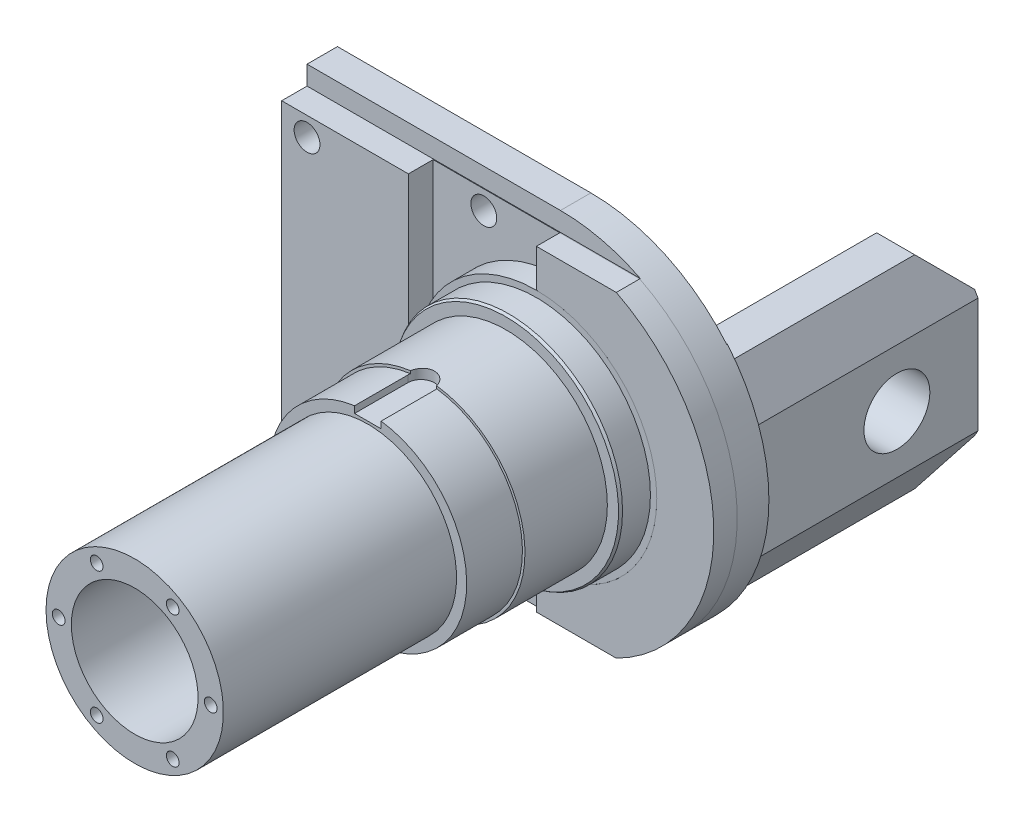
SolidWorks part; units mm, degrees
ref_plane "Face" through (0, 0, 0) normal (0, 0, 1) x (1, 0, 0)
ref_plane "Dessus" through (0, 0, 0) normal (0, 1, 0) x (1, 0, 0)
ref_plane "Droite" through (0, 0, 0) normal (1, 0, 0) x (0, 0, -1)
sketch "Esquisse1" plane through (0, 0, 0) normal (0, 0, 1) x (1, 0, 0)
  line L0 (0, 70) -> (-100, 70)
  line L1 (-100, 70) -> (-100, -70)
  line L2 (-100, -70) -> (0, -70)
  arc A0 (0, -70) -> (0, 70) centre (0, 0) ccw
  dimension "D2" = 140
  dimension "D1" = 100
extrude "Extrusion1" add sketch "Esquisse1" along normal blind 12
sketch "Esquisse2" plane through (0, 0, 12) normal (0, 0, 1) x (1, 0, 0)
  line L0 (-50, 62.5) -> (-100, 62.5)
  line L1 (-100, 70) -> (-100, -70) construction
  line L2 (-100, 62.5) -> (-100, -62.5)
  line L3 (-100, -62.5) -> (-50, -62.5)
  line L4 (-50, 62.5) -> (-50, -62.5)
  line L5 (0, 0) -> (42.8334, 0) construction
  dimension "D1" = 125
  dimension "D2" = 50
extrude "Extrusion2" add sketch "Esquisse2" along normal blind 10
sketch "Esquisse3" plane through (0, 0, 12) normal (0, 0, 1) x (1, 0, 0)
  circle A0 centre (0, 0) radius 47.5
  dimension "D1" = 95
extrude "Enlèv. mat.-Extru.2" cut sketch "Esquisse3" against normal through all
sketch "Esquisse5" plane through (0, 0, 0) normal (0, 1, 0) x (1, 0, 0)
  line L0 (0, 0) -> (0, -73.0964) construction
  line L1 (47.5, 0) -> (47.5, -33.5)
  line L2 (47.5, -33.5) -> (40, -33.5)
  line L3 (40, -33.5) -> (40, -66)
  line L4 (40, -66) -> (39, -66)
  line L5 (25, -180) -> (25, 0)
  line L6 (47.5, 0) -> (-47.5, 0) construction
  line L7 (25, 0) -> (47.5, 0)
  line L8 (47.5, 22.2377) -> (47.5, -49.295) construction
  line L9 (70, 0) -> (0, 0) construction
  line L10 (39, -66) -> (39, -88)
  line L11 (35, -180) -> (25, -180)
  line L12 (39, -88) -> (35, -88)
  line L13 (35, -88) -> (35, -180)
  dimension "D1" = 47.5
  dimension "D2" = 80
  dimension "D3" = 22.5
  dimension "D4" = 33.5
  dimension "D5" = 78
  dimension "D6" = 180
  dimension "D7" = 32.5
  dimension "D8" = 70
  dimension "D9" = 22
revolve "Révolution1" add sketch "Esquisse5" angle 360 about L0
sketch "Esquisse19" plane through (0, 0, 0) normal (0, 0, -1) x (-1, 0, 0)
  line L0 (100, 45) -> (15.2069, 45)
  line L1 (100, -45) -> (15.2069, -45)
  line L2 (-15.2069, 45) -> (-53.619, 45)
  line L3 (0, -70) -> (100, -70)
  line L4 (100, -70) -> (100, 70)
  line L5 (100, 70) -> (0, 70)
  line L7 (100, -45) -> (100, 45)
  line L9 (-15.2069, -45) -> (-53.619, -45)
  circle A0 centre (0, 0) radius 47.5 construction
  arc A1 (0, 70) -> (0, -70) centre (0, 0) ccw
  arc A2 (-53.619, 45) -> (-53.619, -45) centre (0, 0) ccw
  arc A3 (-15.2069, 45) -> (-15.2069, -45) centre (0, 0) ccw
  circle A4 centre (0, 0) radius 47.5 construction
  arc A5 (15.2069, -45) -> (15.2069, 45) centre (0, 0) ccw
  dimension "D2" = 90
  dimension "D1" = 0
extrude "Extrusion8" add sketch "Esquisse19" along normal blind 0.25
sketch "Esquisse6" plane through (0, 0, -0.25) normal (0, 0, -1) x (-1, 0, 0)
  line L0 (-55, 40) -> (-40, 40)
  line L1 (-40, 40) -> (-40, -40)
  line L2 (-40, -40) -> (-55, -40)
  line L3 (-55, -40) -> (-65, -22.6795)
  line L4 (-65, -22.6795) -> (-65, 22.6795)
  line L5 (-65, 22.6795) -> (-55, 40)
  line L6 (0, 0) -> (-67.8088, 0) construction
  dimension "D1" = 80
  dimension "D2" = 25
  dimension "D3" = 30
  dimension "D4" = 15
  dimension "D5" = 40
extrude "Extrusion5" add sketch "Esquisse6" along normal blind 87.5 separate body
sketch "Esquisse7" plane through (65, 0, 0) normal (1, 0, 0) x (0, 0, -1)
  line L0 (87.75, 22.6795) -> (87.75, -22.6795) construction
  circle A0 centre (55.75, 0) radius 13
  dimension "D2" = 26
  dimension "D1" = 32
extrude "Enlèv. mat.-Extru.3" cut sketch "Esquisse7" against normal up to next
sketch "Esquisse8" plane through (0, 0, 88) normal (0, 0, 1) x (1, 0, 0)
  line L0 (0, 0) -> (0, 69.4516) construction
  line L1 (-5.25, 40) -> (5.25, 40)
  line L2 (-5.25, 40) -> (-5.25, 36)
  line L3 (-5.25, 36) -> (5.25, 36)
  line L4 (5.25, 40) -> (5.25, 36)
  circle A0 centre (0, 0) radius 40 construction
  dimension "D1" = 10.5
  dimension "D2" = 76
extrude "Enlèv. mat.-Extru.4" cut sketch "Esquisse8" against normal blind 21
hole_wizard "Trou taraudé M61" positions "Esquisse12" profile "Esquisse11" tap size "M6" standard "ISO"
sketch "Esquisse12" plane through (0, 0, 180) normal (0, 0, 1) x (1, 0, 0)
  point P0 (30, 0)
  dimension "D1" = 30
sketch "Esquisse11" plane through (30, 0, 180) normal (1, 0, 0) x (0, -1, 0)
  line L0 (0, 0) -> (0, 16.4434)
  line L1 (0, 16.4434) -> (2.5, 15)
  line L2 (2.5, 15) -> (2.5, 0)
  line L5 (2.5, 0) -> (0, 0)
  line L10 (0, 16.4434) -> (-2.5, 15) construction
  line L11 (0, -6.35) -> (0, 107.95) construction
  dimension "Diamètre du trou pour taraudage" = 5
  dimension "Profondeur du trou pour taraudage" = 15
  dimension "Angle de pointe" = 120
pattern_circular "Répétition circulaire1" count 6 over 360 about axis through (0, 0, 0) along (0, 0, 1) of "Trou taraudé M61"
hole_wizard "Trou taraudé M121" positions "Esquisse15" profile "Esquisse14" tap size "M12" standard "ISO"
sketch "Esquisse15" plane through (0, 0, 0) normal (0, 0, -1) x (-1, 0, 0)
  line L0 (0, 0) -> (116.6517, 0) construction
  line L2 (100, 70) -> (100, 45) construction
  point P0 (90, 55)
  point P1 (90, -55)
  dimension "D1" = 10
  dimension "D2" = 110
sketch "Esquisse14" plane through (-90, 55, 0) normal (1, 0, 0) x (0, 1, 0)
  line L0 (0, 0) -> (0, 180)
  line L1 (0, 180) -> (5.1, 180)
  line L2 (5.1, 180) -> (5.1, 0)
  line L5 (5.1, 0) -> (0, 0)
  line L11 (0, -6.35) -> (0, 107.95) construction
  dimension "Diamètre du trou pour taraudage jusqu'au prochain" = 10.2
  dimension "Profondeur du trou pour taraudage jusqu'au prochain" = 180
chamfer "Chanfrein1" distance 15 angle 45 2 edges at (47.5, -40, -87.75) (47.5, 40, -87.75)
sketch "Esquisse16" plane through (0, 36, 0) normal (0, 1, 0) x (-1, 0, 0)
  line L0 (-5.25, 67) -> (-5.25, 88) construction
  line L2 (5.25, 88) -> (5.25, 67) construction
  line L3 (5.25, 67) -> (-5.25, 67) construction
  circle A0 centre (0, 67) radius 5.25
extrude "Enlèv. mat.-Extru.5" cut sketch "Esquisse16" along normal up to next
sketch "Esquisse18" plane through (0, 0, 12) normal (0, 0, 1) x (1, 0, 0)
  line L0 (-50, 62.5) -> (31.5238, 62.5)
  line L1 (-50, -62.5) -> (31.5238, -62.5)
  line L9 (-50, -62.5) -> (-100, -62.5)
  line L10 (-100, -62.5) -> (-100, -70)
  line L11 (-100, -70) -> (0, -70)
  line L12 (0, 70) -> (-100, 70)
  line L13 (-100, 70) -> (-100, 62.5)
  line L14 (-100, 62.5) -> (-50, 62.5)
  line L15 (-50, 62.5) -> (-50, -62.5)
  line L22 (-50, 62.5) -> (-50, -62.5)
  arc A0 (0, -70) -> (0, 70) centre (0, 0) ccw construction
  arc A1 (31.5238, -62.5) -> (31.5238, 62.5) centre (0, 0) ccw
  circle A2 centre (0, 0) radius 47.5 construction
  arc A3 (0, -70) -> (0, 70) centre (0, 0) ccw
  circle A4 centre (0, 0) radius 47.5
  dimension "D1" = 0
extrude "Extrusion6" add sketch "Esquisse18" along normal blind 0.25
pattern_linear "Répétition linéaire1" count 2 spacing 60 along (1, 0, 0) of "Trou taraudé M121"
sketch "Esquisse17" plane through (0, 0, 33.5) normal (0, 0, 1) x (1, 0, 0)
  circle A0 centre (0, 0) radius 47.5 construction
  circle A1 centre (0, 0) radius 47.5
  circle A2 centre (0, 0) radius 45
  dimension "D1" = 90
extrude "Enlèv. mat.-Extru.6" cut sketch "Esquisse17" against normal blind 12
chamfer "Chanfrein2" distance 1 angle 30 1 edges at (45, 0, 33.5)
sketch "Esquisse20" plane through (0, 0, 0) normal (0, 0, -1) x (-1, 0, 0)
  line L0 (-15.2069, 45) -> (15.2069, 45)
  line L1 (-15.2069, -45) -> (15.2069, -45)
  circle A0 centre (0, 0) radius 25 construction
  circle A1 centre (0, 0) radius 47.5
  arc A2 (-15.2069, 45) -> (-15.2069, -45) centre (0, 0) ccw
  circle A3 centre (0, 0) radius 25
  arc A4 (15.2069, -45) -> (15.2069, 45) centre (0, 0) ccw
  dimension "D1" = 0
extrude "Extrusion9" add sketch "Esquisse20" along normal blind 0.25
sketch "Esquisse23" plane through (0, 0, 12.25) normal (0, 0, 1) x (1, 0, 0)
  line L0 (-50, -62.5) -> (31.5238, -62.5) construction
  line L1 (31.5238, 62.5) -> (-50, 62.5) construction
  line L2 (0, -62.5) -> (31.5238, -62.5)
  line L3 (31.5238, 62.5) -> (0, 62.5)
  line L4 (0, 62.5) -> (0, 47.5)
  line L5 (0, -47.5) -> (0, -62.5)
  arc A0 (31.5238, -62.5) -> (31.5238, 62.5) centre (0, 0) ccw construction
  arc A1 (31.5238, -62.5) -> (31.5238, 62.5) centre (0, 0) ccw
  circle A2 centre (0, 0) radius 47.5 construction
  arc A3 (0, -47.5) -> (0, 47.5) centre (0, 0) ccw
extrude "Extrusion11" add sketch "Esquisse23" along normal up to surface (9.25 mm away) separate body
sketch "Esquisse24" plane through (0, 0, -87.75) normal (0, 0, -1) x (-1, 0, 0)
  line L1 (112.9251, -79.9643) -> (-94.17, -79.9643)
  line L2 (112.9251, -79.9643) -> (112.9251, 0)
  line L3 (112.9251, 0) -> (-94.17, 0)
  line L4 (-94.17, -79.9643) -> (-94.17, 0)
extrude "Enlèv. mat.-Extru.7" [suppressed] cut sketch "Esquisse24" against normal through all
